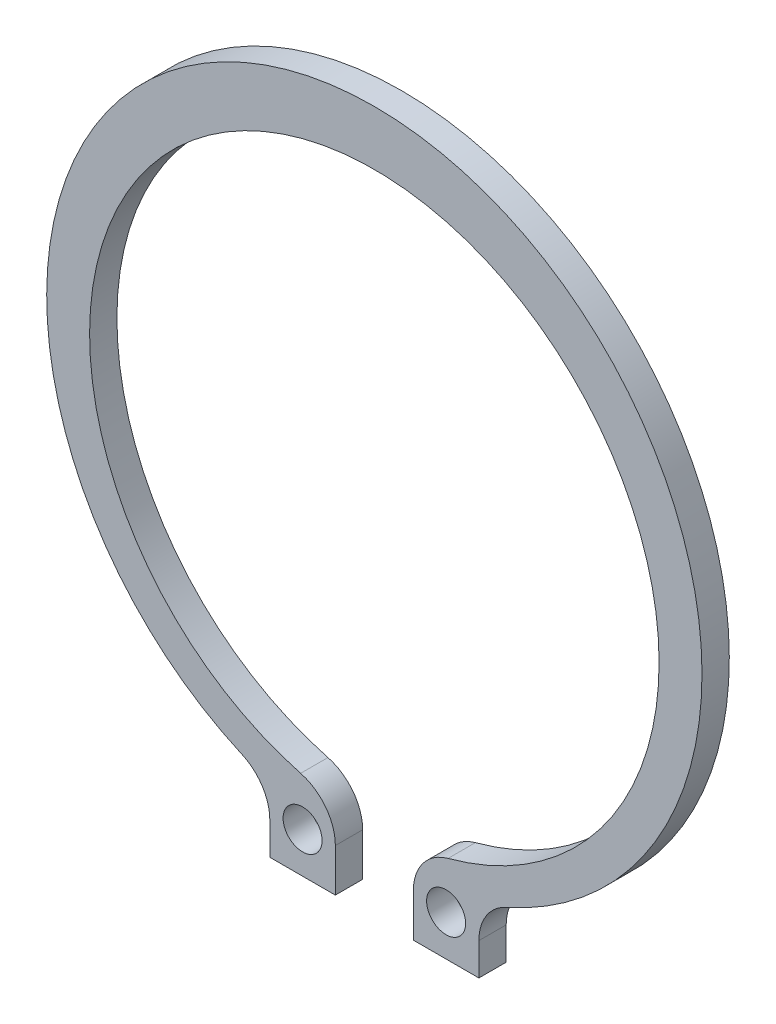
SolidWorks part; units mm, degrees
ref_plane "Front Plane" through (0, 0, 0) normal (0, 0, 1) x (1, 0, 0)
ref_plane "Top Plane" through (0, 0, 0) normal (0, 1, 0) x (1, 0, 0)
ref_plane "Right Plane" through (0, 0, 0) normal (1, 0, 0) x (0, 0, -1)
ref_plane "Plane1" through (0, 0, 0) normal (0, 0, 1) x (1, 0, 0)
sketch "Sketch1" plane through (0, 0, 0) normal (0, 0, 1) x (1, 0, 0)
  line L0 (-6.7, -19.1525) -> (-6.7, -23.278)
  line L1 (-6.7, -23.278) -> (-2.5, -23.278)
  line L2 (-2.5, -23.278) -> (-2.5, -18.078)
  line L3 (2.5, -18.078) -> (2.5, -23.278)
  line L4 (2.5, -23.278) -> (6.7, -23.278)
  line L5 (6.7, -23.278) -> (6.7, -19.1525)
  line L6 (0, 24.1353) -> (0, -22.841) construction
  line L7 (-2.5, -18.078) -> (2.5, -18.078) construction
  line L8 (0, -18.078) -> (0, 0) construction
  arc A0 (6.7, -19.1525) -> (-6.7, -19.1525) centre (0, 0.75) ccw
  arc A1 (2.5, -18.078) -> (-2.5, -18.078) centre (0, 0) ccw
  dimension "D1" = 18.25
  dimension "D2" = 21
  dimension "D3" = 0.75
  dimension "D4" = 5
  dimension "D8" = 4.2
  dimension "D9" = 5.2
extrude "Boss-Extrude1" add sketch "Sketch1" along normal blind 1.75
sketch "Sketch2" plane through (0, 0, 0) normal (0, 0, -1) x (-1, 0, 0)
  line L1 (-2.5, -18.078) -> (-6.7, -18.078) construction
  line L2 (-6.7, -23.278) -> (-6.7, -19.1525) construction
  line L3 (-4.6, -18.078) -> (-4.6, -20.678) construction
  line L4 (-4.6, -20.678) -> (-4.6, -23.278) construction
  line L5 (-2.5, -23.278) -> (-6.7, -23.278) construction
  circle A0 centre (-4.6, -20.678) radius 1.25
  dimension "D2" = 2.5
extrude "Cut-Extrude1" cut sketch "Sketch2" against normal through all
fillet "Fillet1" radius 3 2 edges at (-6.7, -19.1525, 0.875) (6.7, -19.1525, 0.875)
fillet "Fillet2" radius 3 2 edges at (-2.5, -18.078, 0.875) (2.5, -18.078, 0.875)
mirror "Mirror1" about plane through (0, 0, 0) normal (1, 0, 0) of "Cut-Extrude1"
